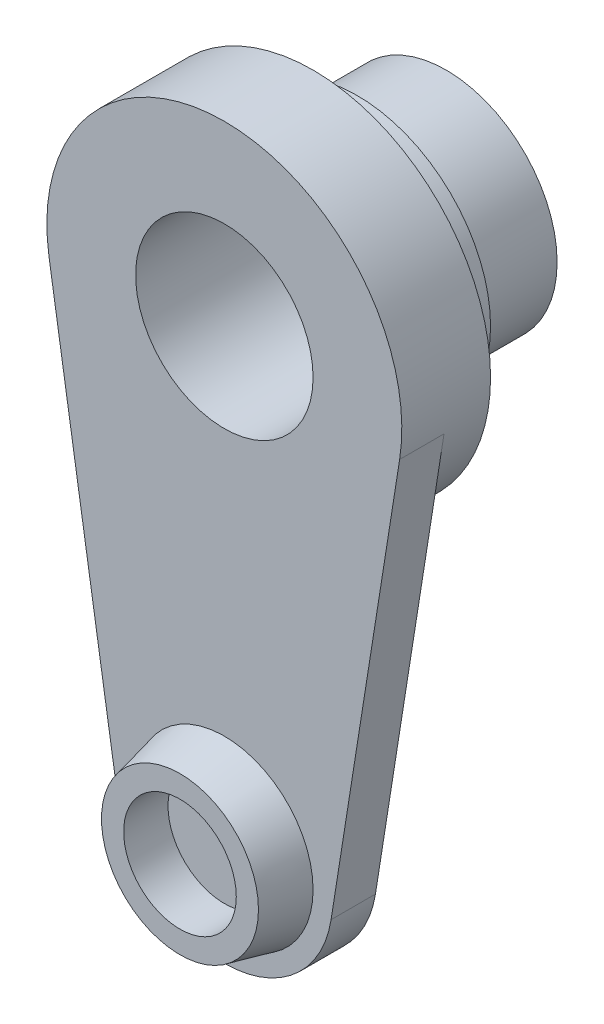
SolidWorks part; units mm, degrees
ref_plane "Front" through (0, 0, 0) normal (0, 0, 1) x (1, 0, 0)
ref_plane "Top" through (0, 0, 0) normal (0, 1, 0) x (1, 0, 0)
ref_plane "Right" through (0, 0, 0) normal (1, 0, 0) x (0, 0, -1)
sketch "Sketch1" plane through (0, 0, 0) normal (0, 0, 1) x (1, 0, 0)
  circle A0 centre (0, 0) radius 7.9375
  circle A1 centre (0, 0) radius 6.35
  dimension "D1" = 15.875
  dimension "D2" = 12.7
extrude "Extrude1" add sketch "Sketch1" along normal blind 6.35
sketch "Sketch2" plane through (0, 0, 6.35) normal (0, 0, 1) x (1, 0, 0)
  circle A0 centre (0, 0) radius 9.525
  circle A1 centre (0, 0) radius 6.35 construction
  circle A2 centre (0, 0) radius 6.35
  dimension "D1" = 19.05
extrude "Extrude2" add sketch "Sketch2" along normal blind 3.175
sketch "Sketch3" plane through (0, 0, 9.525) normal (0, 0, 1) x (1, 0, 0)
  circle A2 centre (0, 0) radius 6.35 construction
  circle A4 centre (0, 0) radius 6.35
  circle A7 centre (0, 0) radius 12.7
  circle A8 centre (0, 0) radius 12.7
  dimension "D1" = 3.175
extrude "Extrude3" add sketch "Sketch3" along normal blind 3.175
sketch "Sketch5" plane through (0, 0, 12.7) normal (0, 0, 1) x (1, 0, 0)
  line L0 (0, 0) -> (0, -31.75) construction
  line L1 (12.5436, -1.9867) -> (7.638, -32.9597)
  line L2 (-12.5436, -1.9867) -> (-7.638, -32.9597)
  circle A0 centre (0, 0) radius 12.7 construction
  arc A1 (-7.638, -32.9597) -> (7.638, -32.9597) centre (0, -31.75) ccw
  arc A2 (12.5436, -1.9867) -> (-12.5436, -1.9867) centre (0, 0) ccw
  circle A3 centre (0, 0) radius 6.35 construction
  circle A4 centre (0, 0) radius 6.35
  dimension "D1" = 31.75
  dimension "D2" = 9
extrude "Extrude5" add sketch "Sketch5" along normal blind 3.175
sketch "Sketch6" plane through (0, 0, 15.875) normal (0, 0, 1) x (1, 0, 0)
  circle A0 centre (0, -31.75) radius 6.35
  dimension "D1" = 12.7
extrude "Extrude6" add sketch "Sketch6" along normal blind 3.175 draft 13
sketch "Sketch7" plane through (0, 0, 19.05) normal (0, 0, 1) x (1, 0, 0)
  circle A2 centre (0, -31.75) radius 4.0295
  circle A3 centre (0, -31.75) radius 4.0295
  dimension "D1" = 1.5875
extrude "Cut-Extrude1" cut sketch "Sketch7" against normal up to surface (3.175 mm away)
